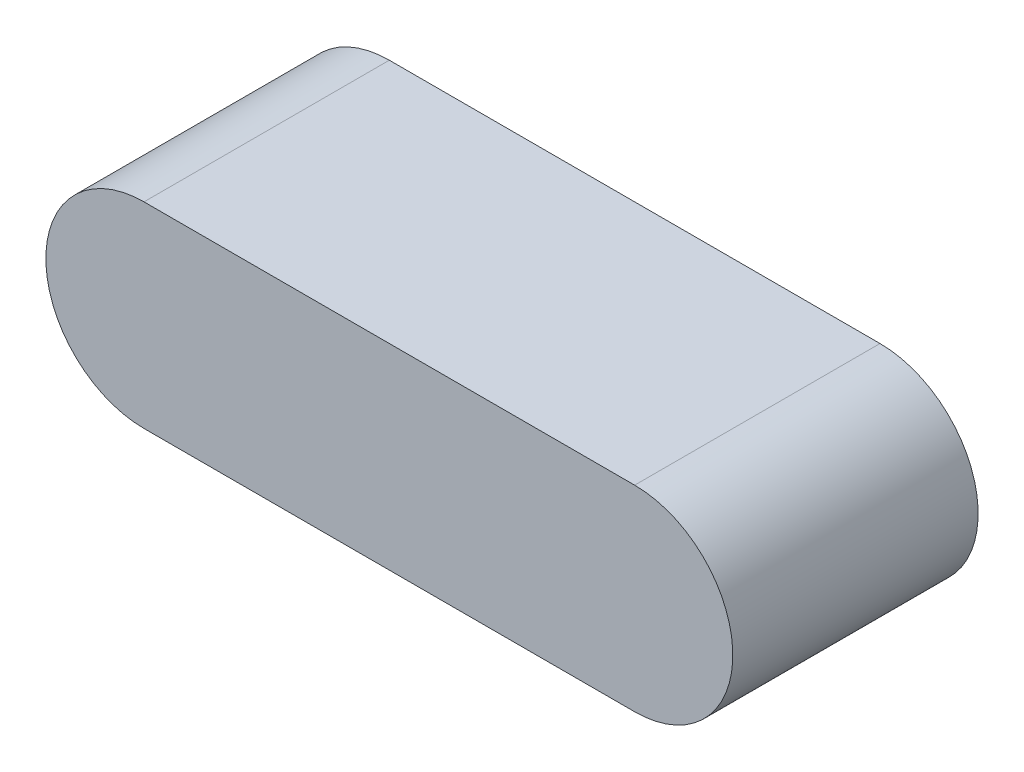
SolidWorks part; units mm, degrees
ref_plane "前视基准面" through (0, 0, 0) normal (0, 0, 1) x (1, 0, 0)
ref_plane "上视基准面" through (0, 0, 0) normal (0, 1, 0) x (1, 0, 0)
ref_plane "右视基准面" through (0, 0, 0) normal (1, 0, 0) x (0, 0, -1)
sketch "草图1" plane through (0, 0, 0) normal (0, 0, 1) x (1, 0, 0)
  line L0 (2, 0) -> (-2, 0) construction
  line L1 (2, -0.8) -> (-2, -0.8)
  line L2 (2, 0.8) -> (-2, 0.8)
  arc A0 (2, -0.8) -> (2, 0.8) centre (2, 0) ccw
  arc A1 (-2, 0.8) -> (-2, -0.8) centre (-2, 0) ccw
  point P2 (0, 0)
  dimension "D1" = 0.8
  dimension "D2" = 4
extrude "凸台-拉伸1" add sketch "草图1" along normal mid plane 2
